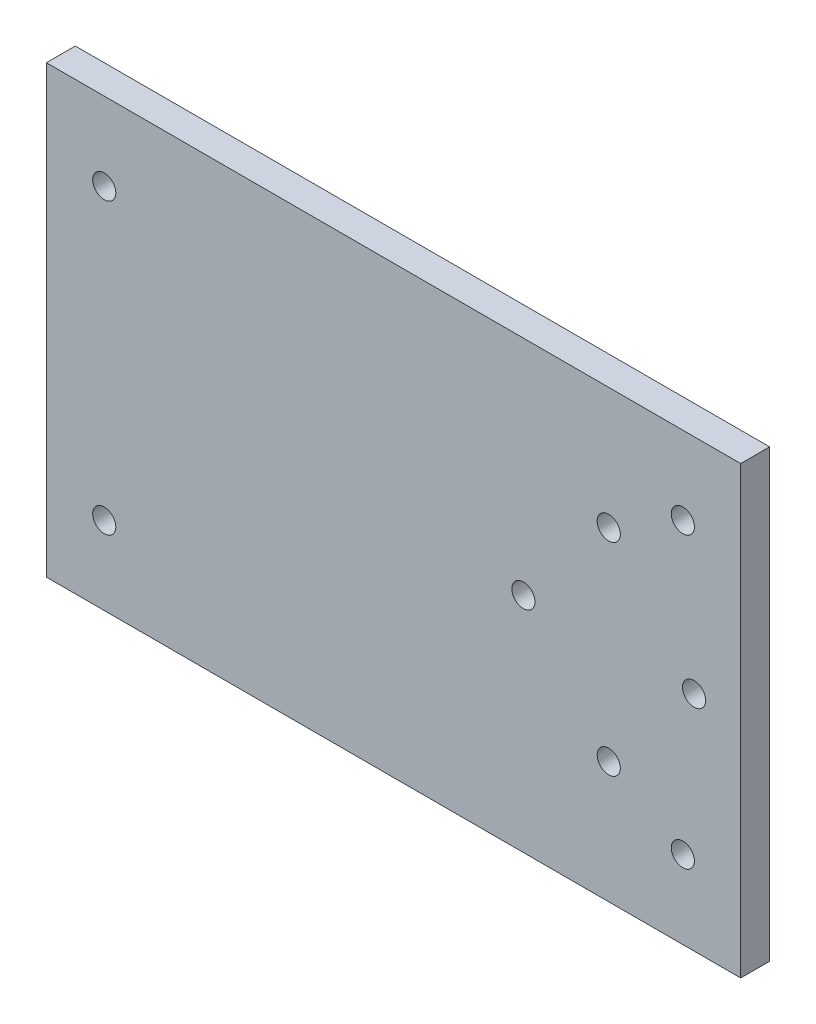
SolidWorks part; units mm, degrees
ref_plane "Plan de face" through (0, 0, 0) normal (0, 0, 1) x (1, 0, 0)
ref_plane "Plan de dessus" through (0, 0, 0) normal (0, 1, 0) x (1, 0, 0)
ref_plane "Plan de droite" through (0, 0, 0) normal (1, 0, 0) x (0, 0, -1)
sketch "Esquisse1" plane through (0, 0, 0) normal (0, 0, 1) x (1, 0, 0)
  line L1 (0, 0) -> (240, 0)
  line L2 (0, 0) -> (0, 154)
  line L3 (0, 154) -> (240, 154)
  line L4 (240, 0) -> (240, 154)
  dimension "D1" = 154
  dimension "D2" = 240
extrude "Boss.-Extru.1" add sketch "Esquisse1" along normal blind 10
sketch "Esquisse2" plane through (0, 0, 10) normal (0, 0, 1) x (1, 0, 0)
  line L0 (0, 0) -> (240, 0) construction
  line L2 (240, 154) -> (0, 154) construction
  line L3 (0, 0) -> (240, 0) construction
  line L4 (0, 154) -> (0, 0) construction
  circle A0 centre (20, 27) radius 4
  circle A1 centre (20, 127) radius 4
  circle A2 centre (220, 27) radius 4
  circle A3 centre (220, 127) radius 4
  dimension "D1" = 100
  dimension "D2" = 27
  dimension "D3" = 20
  dimension "D6" = 100
  dimension "D7" = 27
  dimension "D8" = 27
  dimension "D9" = 200
extrude "Enlèv. mat.-Extru.1" cut sketch "Esquisse2" against normal blind 10
sketch "Esquisse3" plane through (0, 0, 10) normal (0, 0, 1) x (1, 0, 0)
  line L0 (240, 0) -> (240, 154) construction
  line L1 (0, 0) -> (240, 0) construction
  line L2 (240, 154) -> (0, 154) construction
  circle A0 centre (164.89, 77.0098) radius 4
  circle A1 centre (223.89, 77) radius 4
  circle A2 centre (194.39, 112.0098) radius 4
  circle A3 centre (194.39, 42.0098) radius 4
  point P8 (240, 77)
  dimension "D1" = 70
  dimension "D2" = 35
  dimension "D3" = 59
  dimension "D4" = 29.5
  dimension "D5" = 29.5
  dimension "D6" = 16.11
  dimension "D7" = 77
  dimension "D8" = 77
extrude "Enlèv. mat.-Extru.2" cut sketch "Esquisse3" against normal blind 10
chamfer "Chanfrein1" distance 3 angle 45 4 edges at (168.89, 77.0098, 0) (198.39, 112.0098, 0) (227.89, 77, 0) (198.39, 42.0098, 0)
